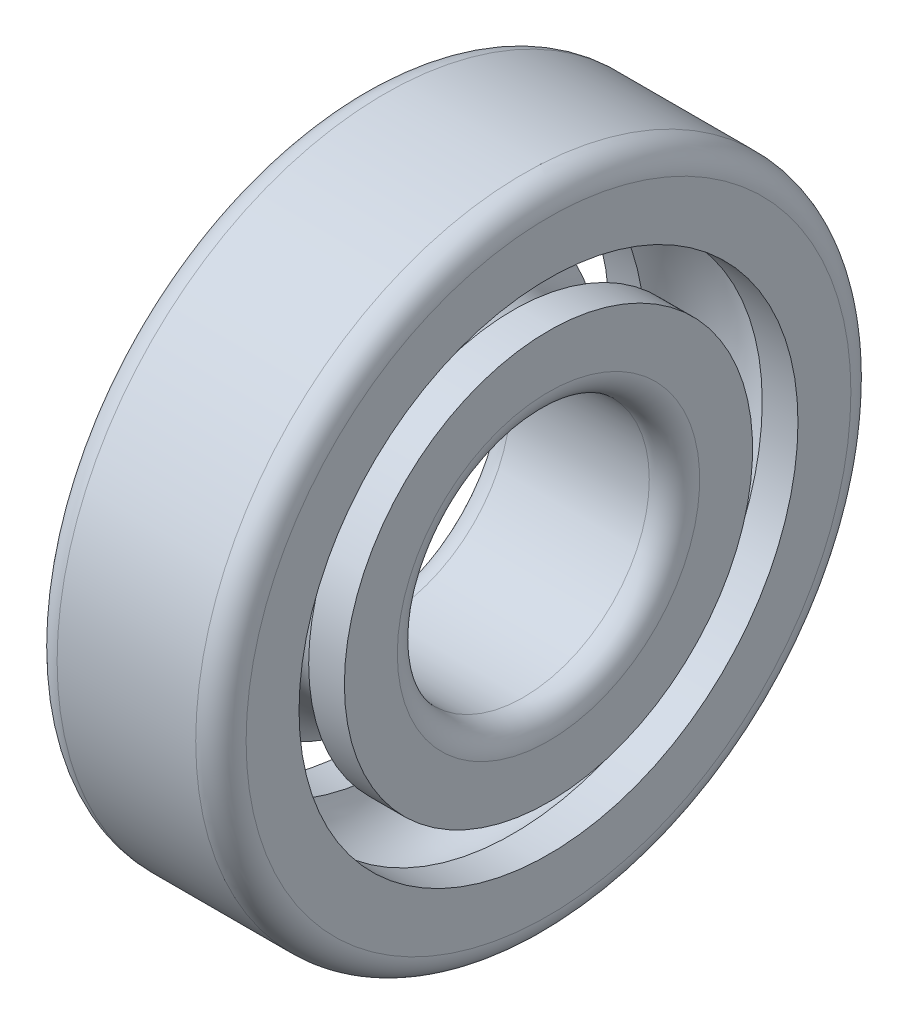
SolidWorks part; units mm, degrees
ref_plane "Front Plane" through (0, 0, 0) normal (0, 0, 1) x (1, 0, 0)
ref_plane "Top Plane" through (0, 0, 0) normal (0, 1, 0) x (1, 0, 0)
ref_plane "Right Plane" through (0, 0, 0) normal (1, 0, 0) x (0, 0, -1)
sketch "Sketch2" plane through (0, 0, 0) normal (0, 1, 0) x (1, 0, 0)
  line L0 (0, 0) -> (0, 5) construction
  line L1 (-2.75, 5) -> (2.75, 5)
  line L2 (3.75, 6) -> (3.75, 8.1)
  line L3 (2.75, 13) -> (-2.75, 13)
  line L4 (-3.75, 12) -> (-3.75, 9.9)
  line L5 (0, 5) -> (0, 6.5) construction
  line L6 (-3.75, 9.9) -> (-2.3324, 9.9)
  line L7 (3.75, 8.1) -> (2.3324, 8.1)
  line L8 (2.3324, 9.9) -> (3.75, 9.9)
  line L9 (0, 11.5) -> (0, 13) construction
  line L10 (-2.3324, 8.1) -> (-3.75, 8.1)
  line L12 (-3.75, 8.1) -> (-3.75, 6)
  line L13 (3.75, 9.9) -> (3.75, 12)
  line L14 (-1.2651, 0) -> (1.6505, 0) construction
  arc A0 (-2.75, 5) -> (-3.75, 6) centre (-2.75, 6) cw
  arc A1 (2.75, 5) -> (3.75, 6) centre (2.75, 6) ccw
  arc A2 (3.75, 12) -> (2.75, 13) centre (2.75, 12) ccw
  arc A3 (-2.75, 13) -> (-3.75, 12) centre (-2.75, 12) ccw
  arc A4 (-2.3324, 8.1) -> (2.3324, 8.1) centre (0, 9) ccw
  arc A5 (2.3324, 9.9) -> (-2.3324, 9.9) centre (0, 9) ccw
  dimension "D4" = 1
  dimension "D5" = 2.5
  dimension "D1" = 7.5
  dimension "D2" = 5
  dimension "D3" = 13
  dimension "D6" = 3.1
  dimension "D7" = 3.1
revolve "Revolve1" add sketch "Sketch2" angle 360 about L14
